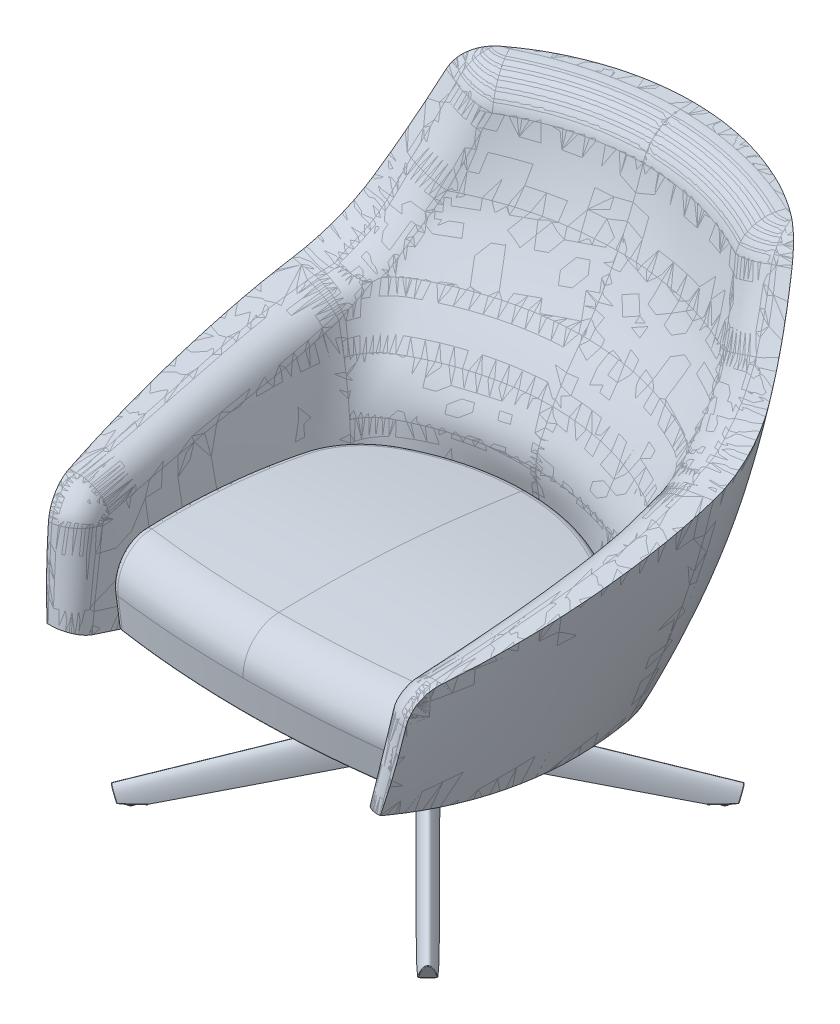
SolidWorks part; units mm, degrees
ref_plane "Plane1" through (0, 0, 0) normal (0, 0, 1) x (1, 0, 0)
ref_plane "Plane2" through (0, 0, 0) normal (0, 1, 0) x (1, 0, 0)
ref_plane "Plane3" through (0, 0, 0) normal (1, 0, 0) x (0, 0, -1)
imported_body "Puk onderstel vierteens hout-1/Puk onderstel vierteens hout kolom-1-solid1"
imported_body "Puk onderstel vierteens hout-1/Puk onderstel vierteens hout poot staal-1-solid1"
imported_body "Puk onderstel vierteens hout-1/Puk onderstel vierteens hout poot staal-2-solid1"
imported_body "Puk onderstel vierteens hout-1/Puk onderstel vierteens hout poot staal-3-solid1"
imported_body "Puk onderstel vierteens hout-1/Puk onderstel vierteens hout poot staal-4-solid1"
imported_body "Puk onderstel vierteens hout-1/Puk onderstel vierteens hout poot staal voetje-2-solid1"
imported_body "Puk onderstel vierteens hout-1/Puk onderstel vierteens hout-1-solid1"
imported_body "Puk onderstel vierteens hout-1/Pote-00013-1-solid1"
imported_body "Puk onderstel vierteens hout-1/Pote-00013-2-solid1"
imported_body "Puk onderstel vierteens hout-1/Pote-00013-3-solid1"
imported_body "Puk onderstel vierteens hout-1/Pote-00013-4-solid1"
imported_body "Puk onderstel vierteens hout-1/Puk onderstel vierteens hout poot staal voetje-3-solid1"
imported_body "Puk onderstel vierteens hout-1/Puk onderstel vierteens hout poot staal voetje-4-solid1"
imported_body "Puk onderstel vierteens hout-1/Puk onderstel vierteens hout poot staal voetje-5-solid1"
imported_body "Puk onderstel vierteens hout-1/Puk onderstel vierteens hout-2-solid1"
imported_body "Puk onderstel vierteens hout-1/Puk onderstel vierteens hout-3-solid1"
imported_body "Puk onderstel vierteens hout-1/Puk onderstel vierteens hout-4-solid1"
imported_body "Puk low chassis-1/Puk low chassis beugel-1-solid1"
imported_body "Puk low chassis-1/Puk low chassis beugel drager-1-solid1"
imported_body "Puk low chassis-1/Puk low chassis draaibus-2-solid1"
imported_body "Puk model rug-arm-1-solid1"
imported_body "Puk model zitting-1-solid1"
surface "Surface-Offset1" parameters "D1"=0
surface "Surface-Offset2" parameters "D1"=0
